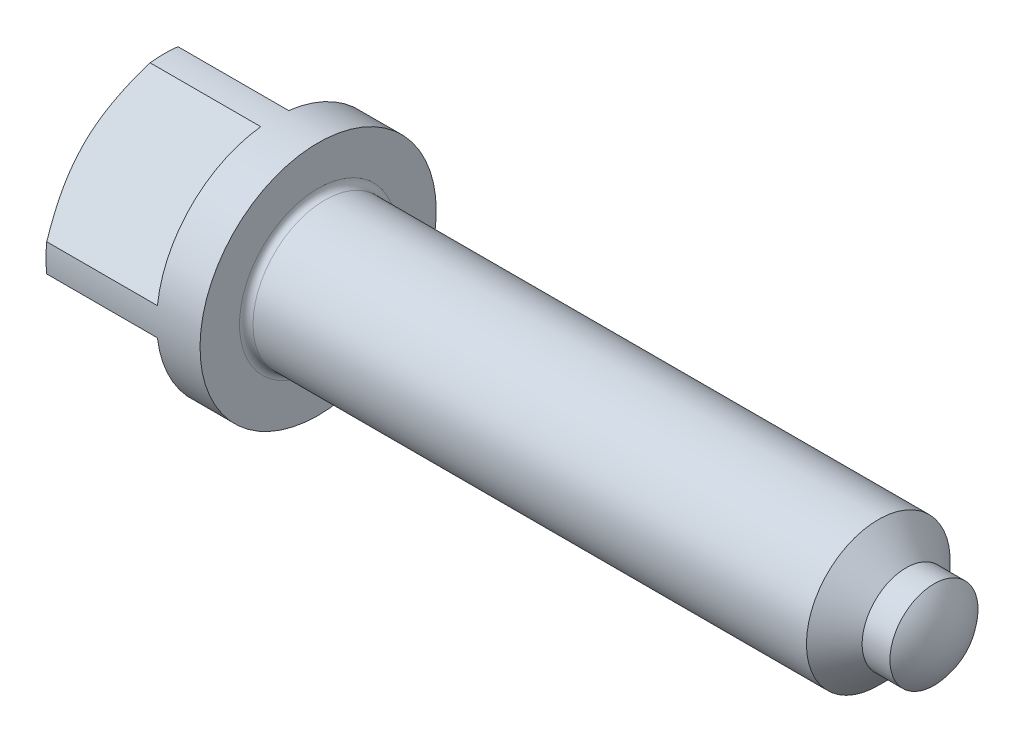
SolidWorks part; units mm, degrees
ref_plane "Plane1" through (0, 0, 0) normal (0, 0, 1) x (1, 0, 0)
ref_plane "Plane2" through (0, 0, 0) normal (0, 1, 0) x (1, 0, 0)
ref_plane "Plane3" through (0, 0, 0) normal (1, 0, 0) x (0, 0, -1)
sketch "SquareSke" plane through (0, 0, 0) normal (1, 0, 0) x (0, 0, -1)
  line L0 (13.9019, -1.6545) -> (1.6545, -13.9019)
  line L1 (-1.6545, -13.9019) -> (-13.9019, -1.6545)
  line L2 (-14, 0) -> (14, 0) construction
  line L3 (-13.9019, -1.6545) -> (13.9019, -1.6545) construction
  line L4 (13.9019, 1.6545) -> (1.6545, 13.9019)
  line L5 (-1.6545, 13.9019) -> (-13.9019, 1.6545)
  arc A0 (-13.9019, 1.6545) -> (-13.9019, -1.6545) centre (0, 0) ccw
  arc A1 (-1.6545, -13.9019) -> (1.6545, -13.9019) centre (0, 0) ccw
  arc A2 (13.9019, -1.6545) -> (13.9019, 1.6545) centre (0, 0) ccw
  arc A3 (1.6545, 13.9019) -> (-1.6545, 13.9019) centre (0, 0) ccw
  dimension "Dflats" = 28
  dimension "Width_flats" = 22
extrude "BaseHead" add sketch "SquareSke" along normal blind 20
sketch "BodySke"
  line L0 (20, 13.9019) -> (20, 1.6545) construction
  line L1 (0, 0) -> (99.0985, 0) construction
  line L2 (0, 8.5208) -> (0, 0)
  line L3 (0, 8.5208) -> (86.4007, 8.5208)
  line L4 (20, 0) -> (0, 0) construction
  line L5 (0, 0) -> (95, 0)
  line L6 (89.7, 5.2215) -> (86.4007, 8.5208)
  line L8 (34.5, 15.24) -> (34.5, 2.1764) construction
  line L10 (22.5, 15.24) -> (22.5, -1.27) construction
  line L11 (93, 5.2215) -> (89.7, 5.2215)
  line L13 (20, 13.9019) -> (20, 1.6545) construction
  arc A0 (95, 0) -> (93, 5.2215) centre (87.1841, 0) ccw
extrude "Collar" add sketch "CollarSke" against normal blind 5.15
sketch "CollarSke" plane through (20, 0, 0) normal (1, 0, 0) x (0, 0, -1)
  circle A0 centre (0, 0) radius 14
  arc A2 (13.9019, -1.6545) -> (13.9019, 1.6545) centre (0, 0) ccw construction
revolve "BaseBody" add sketch "BodySke"
fillet "HeadFillet" radius 0.8 1 edges at (20, 0, -8.5208)
sketch "HeadChamSke" plane through (0, 0, 0) normal (0, 0, 1) x (1, 0, 0)
  line L0 (0, 11) -> (5.5174, 20.5563)
  line L1 (0, 13.9019) -> (0, 1.6545) construction
  line L2 (5.5174, 20.5563) -> (5.5174, 25.5563)
  line L3 (5.5174, 25.5563) -> (-10, 25.5563)
  line L4 (-10, 25.5563) -> (-10, 11)
  line L5 (-10, 11) -> (0, 11)
  line L6 (0, 0) -> (99.06, 0) construction
  line L7 (20, 15.5563) -> (0, 15.5563) construction
  dimension "D1" = 11
  dimension "D2" = 5
  dimension "D3" = 10
  dimension "D4" = 5
  dimension "Head_ch_ang" = 30
revolve "HeadChamfer" cut sketch "HeadChamSke" angle 360 about L6
sketch "ThdSchSke" plane through (0, 0, 0) normal (0, 0, 1) x (1, 0, 0)
  line L0 (22.8, -6) -> (21.0349, -8.5208)
  line L1 (22.8, -6) -> (24.5651, -8.5208)
  line L2 (24.5651, -8.5208) -> (24.5651, -10.651)
  line L3 (-3.175, 0) -> (5.1513, 0) construction
  line L5 (24.5651, -10.651) -> (21.0349, -10.651)
  line L6 (21.0349, -10.651) -> (21.0349, -8.5208)
  dimension "Diameter" = 17.0416
  dimension "Start" = 22.8
  dimension "SideAngle" = 55
  dimension "VeeAngle" = 70
  dimension "Overcut" = 21.302
  dimension "Minor" = 12
revolve "ThreadSchematic" [suppressed] cut sketch "ThdSchSke" angle 360 about L3
pattern_linear "ThdSchPat" [suppressed]
equation "\"Thread_minor@ThreadCosmetic\" = \"Minor_dia@BodySke\""
equation "\"D1@HeadChamSke\" = \"Width_flats@SquareSke\" / 2"
equation "\"Thread_length@ThreadCosmetic\" = \"Length@BodySke\" - \"Point_len@BodySke\" - \"Advance@BodySke\""
equation "\"Diameter@ThdSchSke\" = \"Diameter@BodySke\""
equation "\"Overcut@ThdSchSke\" = \"Diameter@BodySke\" * 1.25"
equation "\"Minor@ThdSchSke\" = \"Minor_dia@BodySke\""
equation "\"Start@ThdSchSke\" = \"Head_ht@BaseHead\" + \"Length@BodySke\" - 2 * \"Advance@BodySke\" - \"Thread_length@ThreadCosmetic\"  '---Non-countersunk---"
equation "\"Num_threads@ThdSchPat\" = int( \"Thread_length@ThreadCosmetic\" / \"Advance@BodySke\" + 0.999 )  + 1"
equation "\"Advance@ThdSchPat\" = \"Thread_length@ThreadCosmetic\" /  (\"Num_threads@ThdSchPat\" - 1) 'relax it"
equation "\"Num_threads@ThdSchPat\" = \"Num_threads@ThdSchPat\" - sgn( \"Num_threads@ThdSchPat\" - 1) '---chamfered tips only---"
equation "\"D1@BodySke\" =  ( \"Diameter@BodySke\" - \"Point_dia@BodySke\" )  / 2"
